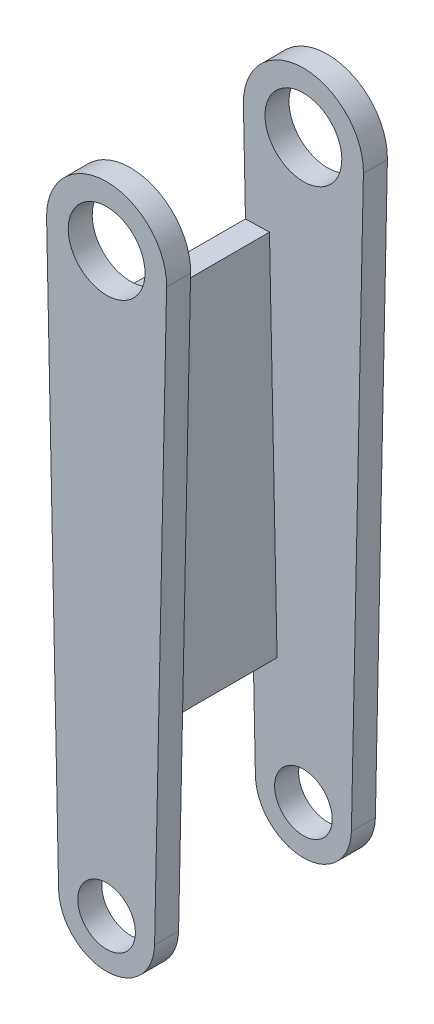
SolidWorks part; units mm, degrees
ref_plane "Front Plane" through (0, 0, 0) normal (0, 0, 1) x (1, 0, 0)
ref_plane "Top Plane" through (0, 0, 0) normal (0, 1, 0) x (1, 0, 0)
ref_plane "Right Plane" through (0, 0, 0) normal (1, 0, 0) x (0, 0, -1)
sketch "Sketch1" plane through (0, 0, 0) normal (0, 0, 1) x (1, 0, 0)
  line L0 (-9.9978, -0.2083) -> (-12.4973, 119.7396)
  line L1 (12.4973, 119.7396) -> (9.9978, -0.2083)
  circle A0 centre (0, 0) radius 6
  arc A1 (-9.9978, -0.2083) -> (9.9978, -0.2083) centre (0, 0) ccw
  arc A2 (12.4973, 119.7396) -> (-12.4973, 119.7396) centre (0, 120) ccw
  circle A3 centre (0, 120) radius 8
  dimension "D1" = 12
  dimension "D2" = 10
  dimension "D3" = 12.5
  dimension "D4" = 16
  dimension "D5" = 120
extrude "Boss-Extrude1" add sketch "Sketch1" along normal blind 46
sketch "Sketch2" plane through (9.9978, -0.2083, 0) normal (-0.9998, 0.0208, 0) x (0, 0, 1)
  line L0 (46, 119.4532) -> (46, -0.4166) construction
  line L1 (5, 165.5521) -> (41, 165.5521)
  line L2 (5, 165.5521) -> (5, -14.8086)
  line L3 (5, -14.8086) -> (41, -14.8086)
  line L4 (41, 165.5521) -> (41, -14.8086)
  line L5 (0, 119.4532) -> (0, -0.4166) construction
  dimension "D1" = 5
  dimension "D2" = 5
extrude "Cut-Extrude1" cut sketch "Sketch2" along normal blind 97
sketch "Sketch5" plane through (-9.9978, -0.2083, 0) normal (-0.9998, -0.0208, 0) x (0, 0, 1)
  line L0 (5, 119.974) -> (5, 0) construction
  line L1 (5, 99.474) -> (41, 99.474)
  line L2 (5, 99.474) -> (5, 23.474)
  line L3 (5, 23.474) -> (41, 23.474)
  line L4 (41, 99.474) -> (41, 23.474)
  line L5 (41, 0) -> (41, 119.974) construction
  dimension "D1" = 76
  dimension "D2" = 33
extrude "Boss-Extrude2" add sketch "Sketch5" against normal blind 5
